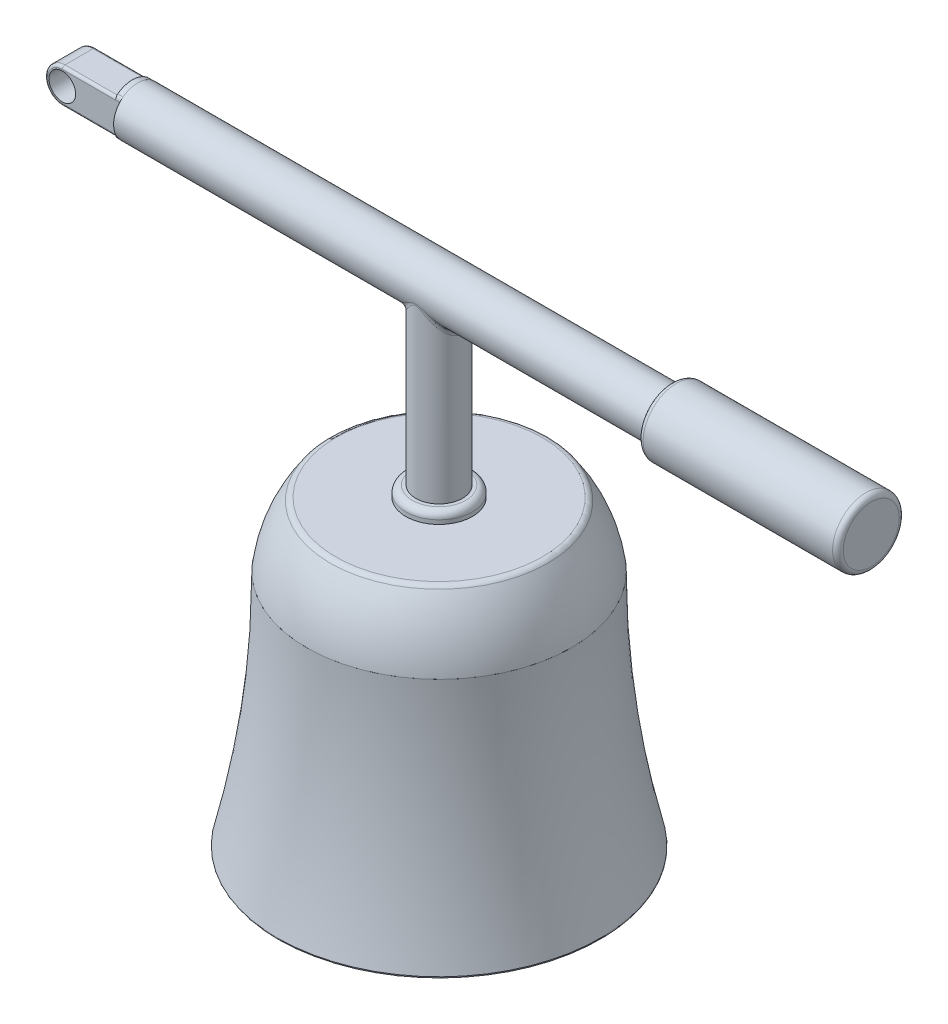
SolidWorks part; units mm, degrees
ref_plane "Front Plane" through (0, 0, 0) normal (0, 0, 1) x (1, 0, 0)
ref_plane "Top Plane" through (0, 0, 0) normal (0, 1, 0) x (1, 0, 0)
ref_plane "Right Plane" through (0, 0, 0) normal (1, 0, 0) x (0, 0, -1)
sketch "Sketch1" plane through (0, 0, 0) normal (0, 0, 1) x (1, 0, 0)
  line L0 (0, 1.3) -> (4, 1.3)
  line L1 (4, 1.3) -> (4, -1.3)
  line L2 (4, -1.3) -> (0, -1.3)
  arc A0 (0, 1.3) -> (0, -1.3) centre (0, 0) ccw
  circle A1 centre (0, 0) radius 1
  dimension "D1" = 1.3
  dimension "D3" = 2
  dimension "D2" = 4
extrude "Boss-Extrude1" add sketch "Sketch1" along normal mid plane 2.5
sketch "Sketch2" plane through (4, 0, 0) normal (1, 0, 0) x (0, 0, -1)
  line L0 (-1.25, 1.3) -> (-1.25, -1.3)
  line L1 (1.25, 1.3) -> (1.25, -1.3)
  arc A0 (-1.25, -1.3) -> (1.25, -1.3) centre (0, 0) ccw
  arc A1 (1.25, 1.3) -> (-1.25, 1.3) centre (0, 0) ccw
fillet "Fillet1" radius 0.2 6 edges at (2, -1.3, -1.25) (-1.3, 0, -1.25) (2, -1.3, 1.25) (-1.3, 0, 1.25) (2, 1.3, -1.25) (2, 1.3, 1.25)
extrude "Boss-Extrude2" add sketch "Sketch2" along normal blind 0.4 contours A1 L0 A0 L1
fillet "Fillet2" radius 0.4 4 edges at (4.2, 1.3, -1.25) (4.2, -1.3, -1.25) (4.2, -1.3, 1.25) (4.2, 1.3, 1.25)
sketch "Sketch3" plane through (4.4, 0, 0) normal (1, 0, 0) x (0, 0, -1)
  circle A0 centre (0, 0) radius 1.8035
  arc A1 (1.0923, 1.4351) -> (-1.0923, 1.4351) centre (0, 0) ccw construction
extrude "Boss-Extrude3" add sketch "Sketch3" along normal blind 40 separate body
sketch "Sketch4" plane through (44.4, 0, 0) normal (1, 0, 0) x (0, 0, -1)
  circle A0 centre (0, 0) radius 2.5
  dimension "D1" = 5
extrude "Boss-Extrude4" add sketch "Sketch4" along normal blind 15
fillet "Fillet3" radius 0.4 2 edges at (44.4, 0, -2.5) (59.4, 0, -2.5)
sketch "Sketch5" plane through (0, 0, 0) normal (0, 1, 0) x (1, 0, 0)
  circle A0 centre (27, 0) radius 1.75
  dimension "D1" = 3.5
  dimension "D2" = 27
extrude "Boss-Extrude5" add sketch "Sketch5" against normal blind 13
fillet "Fillet4" radius 0.5 1 edges at (27.0521, -0.439, -1.7492)
sketch "Sketch6" plane through (0, -13, 0) normal (0, -1, 0) x (1, 0, 0)
  circle A0 centre (27, 0) radius 2.5
  dimension "D1" = 5
extrude "Boss-Extrude6" add sketch "Sketch6" along normal blind 0.8
fillet "Fillet5" radius 0.5 1 edges at (27, -13, -2.5)
sketch "Sketch7" plane through (0, 0, 0) normal (0, 0, 1) x (1, 0, 0)
  line L0 (27, -13.8) -> (35, -13.8)
  line L1 (24.5, -13.8) -> (29.5, -13.8) construction
  line L2 (36.9282, -18.6038) -> (27, -19.8) construction
  line L3 (27, -19.8) -> (35, -13.8) construction
  line L4 (27, -8.7005) -> (27, -26.115) construction
  line L5 (27, -13.8) -> (27, -18.6038)
  line L6 (27, -18.6038) -> (36.9282, -18.6038)
  arc A0 (35, -13.8) -> (36.9282, -18.6038) centre (27, -19.8) cw
  dimension "D2" = 10
  dimension "D1" = 8
  dimension "D3" = 30
revolve "Revolve1" add sketch "Sketch7" angle 360 about L4
fillet "Fillet6" radius 0.5 1 edges at (27, -13.8, 8)
shell "Shell1" thickness 0.1
fillet "Fillet7" [suppressed] radius 0.1
sketch "Sketch8" plane through (0, 0, 0) normal (0, 0, 1) x (1, 0, 0)
  line L0 (27, -13.8) -> (27, -15.3428) construction
  line L1 (24.5, -13.8) -> (29.5, -13.8) construction
sketch "Sketch10" plane through (0, 0, 0) normal (0, 0, 1) x (1, 0, 0)
  line L0 (36.9282, -18.6038) -> (36.8282, -18.6038)
  line L3 (39.1012, -36.4928) -> (39.0041, -36.5167)
  line L4 (36.9282, -18.6038) -> (36.7113, -18.6038) construction
  line L5 (17.0718, -18.6038) -> (36.9282, -18.6038) construction
  spline S0 degree 2 poles (36.9282, -18.6038) (36.9282, -27.644) (39.1012, -36.4928) knots 0 0 0 1 1 1
  spline S1 degree 1 poles (36.8282, -18.6038) (39.0041, -36.5167) knots 0 0 1 1 construction
  spline S2 degree 3 poles (36.8282, -18.6038) (36.8282, -21.6108) (37.1006, -26.1275) (38.0062, -32.0753) (38.643, -35.046) (39.0041, -36.5167) knots 0 0 0 0 0.5 0.75 1 1 1 1
  point P5 (0, 0)
  point P7 (36.8282, -18.6038)
  point P8 (40.1947, -45.736)
  point P12 (37.8481, -45.0092)
  point P13 (39.0041, -36.5167)
  dimension "D1" = 0.1
revolve "Revolve2" add sketch "Sketch10" angle 360 about L0
fillet "Fillet8" radius 0.1 1 edges at (27, -36.4928, 12.1012)
sketch "Sketch11" plane through (0, -13.9, 0) normal (0, -1, 0) x (1, 0, 0)
  circle A0 centre (27, 0) radius 4
  circle A1 centre (27, 0) radius 3.5
  dimension "D1" = 7
  dimension "D2" = 8
extrude "Boss-Extrude7" add sketch "Sketch11" along normal blind 5 separate body
